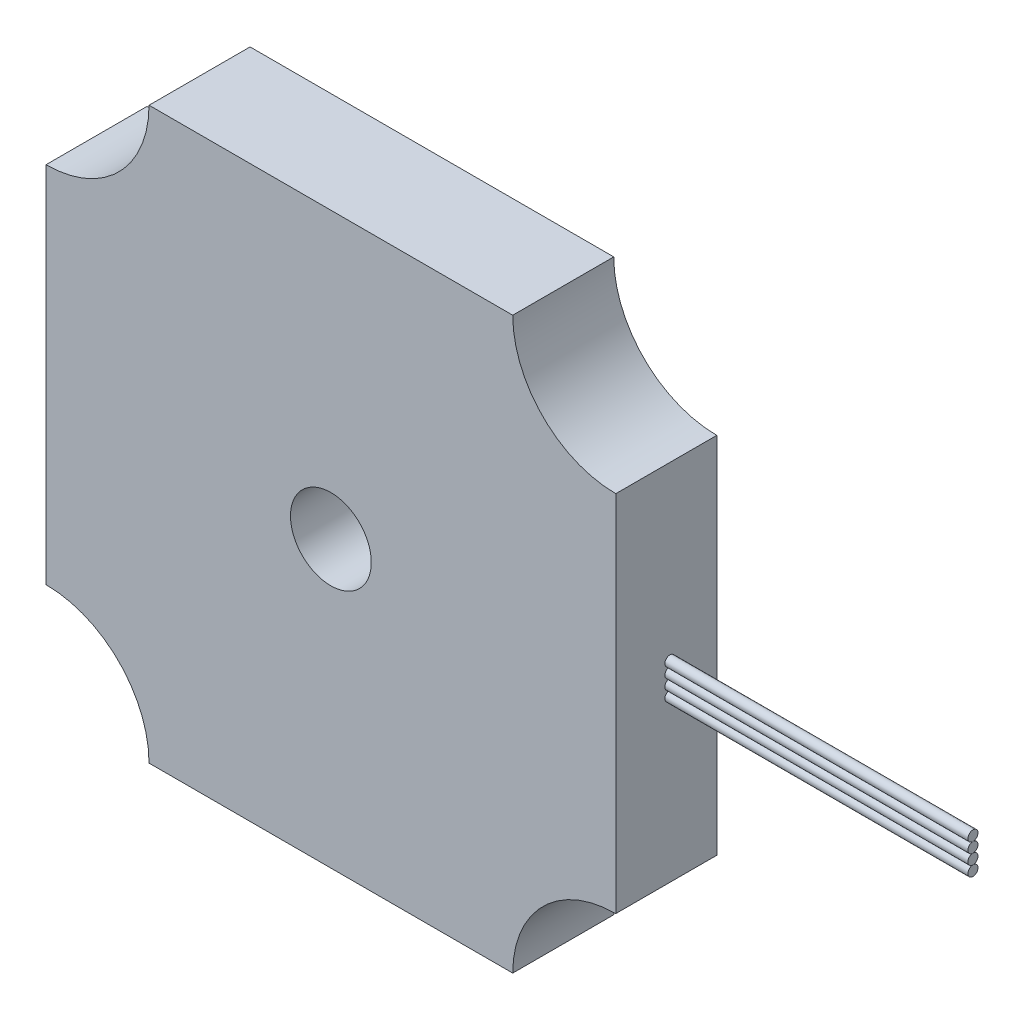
SolidWorks part; units mm, degrees
ref_plane "前视" through (0, 0, 0) normal (0, 0, 1) x (1, 0, 0)
ref_plane "上视" through (0, 0, 0) normal (0, 1, 0) x (1, 0, 0)
ref_plane "右视" through (0, 0, 0) normal (1, 0, 0) x (0, 0, -1)
sketch "草图1" plane through (0, 0, 0) normal (0, 0, 1) x (1, 0, 0)
  line L0 (-18, -28.2) -> (18, -28.2)
  line L2 (28.2, -18) -> (28.2, 18)
  line L3 (18, 28.2) -> (-18, 28.2)
  line L4 (-28.2, -18) -> (-28.2, 18)
  line L5 (28.2, -28.2) -> (-28.2, 28.2) construction
  line L6 (28.2, 28.2) -> (-28.2, -28.2) construction
  line L11 (18, -28.2) -> (-18, 28.2) construction
  line L12 (18, 28.2) -> (-18, -28.2) construction
  line L18 (28.2, -18) -> (-28.2, 18) construction
  line L19 (28.2, 18) -> (-28.2, -18) construction
  arc A0 (-28.2, 18) -> (-18, 28.2) centre (-28.2, 28.2) ccw
  arc A1 (18, 28.2) -> (28.2, 18) centre (28.2, 28.2) ccw
  arc A2 (28.2, -18) -> (18, -28.2) centre (28.2, -28.2) ccw
  arc A3 (-18, -28.2) -> (-28.2, -18) centre (-28.2, -28.2) ccw
  point P0 (0, 0)
  point P6 (0, 0)
  point P11 (0, 0)
  dimension "D1" = 56.4
  dimension "D2" = 56.4
  dimension "D3" = 36
  dimension "D4" = 36
extrude "凸台-拉伸1" add sketch "草图1" along normal blind 10
sketch "草图2" plane through (0, 0, 0) normal (0, 0, -1) x (-1, 0, 0)
  circle A0 centre (0, 0) radius 4
extrude "切除-拉伸1" cut sketch "草图2" against normal blind 10
sketch "草图3" plane through (28.2, 0, 0) normal (1, 0, 0) x (0, 0, -1)
  circle A0 centre (-4.6434, 0) radius 0.5
  circle A1 centre (-4.6434, 1) radius 0.5
  circle A2 centre (-4.6434, -1) radius 0.5
  circle A3 centre (-4.6434, -2) radius 0.5
extrude "凸台-拉伸2" add sketch "草图3" along normal blind 30 separate body contours A3 | A2 | A0 | A1
